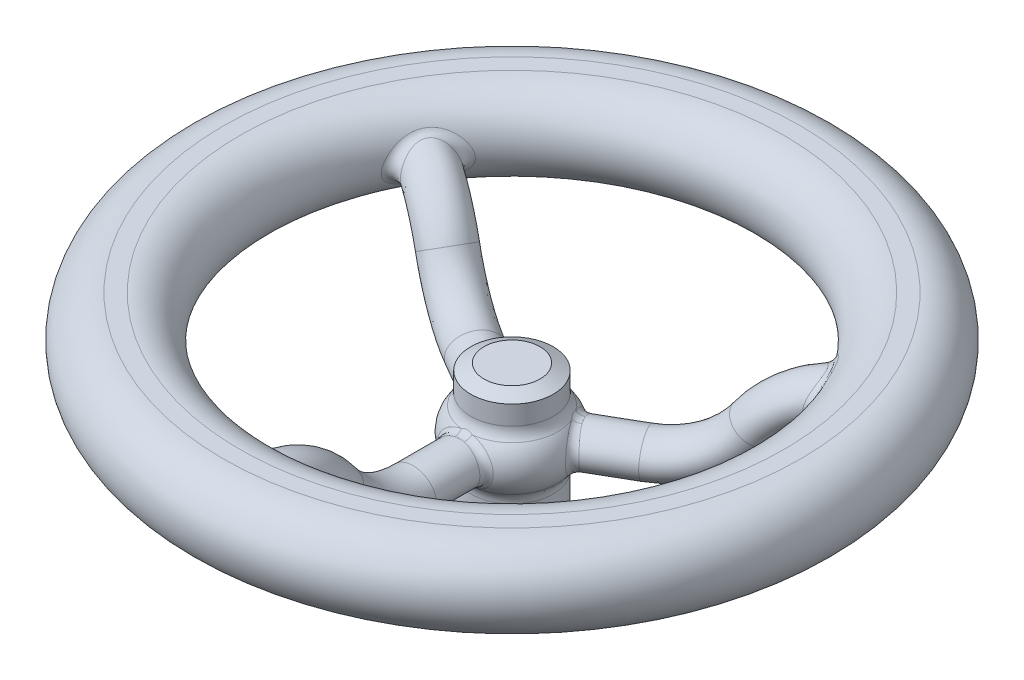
SolidWorks part; units mm, degrees
ref_plane "Front Plane" through (0, 0, 0) normal (0, 0, 1) x (1, 0, 0)
ref_plane "Top Plane" through (0, 0, 0) normal (0, 1, 0) x (1, 0, 0)
ref_plane "Right Plane" through (0, 0, 0) normal (1, 0, 0) x (0, 0, -1)
sketch "Sketch1" plane through (0, 0, 0) normal (1, 0, 0) x (0, 0, -1)
  line L0 (-12.5, 37.198) -> (-12.5, 45)
  line L1 (0, 0) -> (-12.5, 0)
  line L2 (0, 0) -> (0, 45) construction
  line L3 (0, 45) -> (-12.5, 45)
  line L4 (-12.5, 0) -> (-12.5, 16.802)
  line L5 (0, 0) -> (0, 45)
  arc A0 (-13.8333, 33.7987) -> (-13.8333, 20.2013) centre (-6.5, 27) ccw
  arc A1 (-13.8333, 20.2013) -> (-12.5, 16.802) centre (-17.5, 16.802) cw
  arc A2 (-13.8333, 33.7987) -> (-12.5, 37.198) centre (-17.5, 37.198) ccw
  point P10 (-12.5, 19)
  point P13 (-12.5, 35)
  dimension "D6" = 5
  dimension "D1" = 4
  dimension "D2" = 16
  dimension "D3" = 10
  dimension "D4" = 45
  dimension "D5" = 25
revolve "Hub" add sketch "Sketch1" angle 360 about L2
sketch "Sketch2" plane through (0, 0, 0) normal (1, 0, 0) x (0, 0, -1)
  line L0 (-87.5, 51) -> (-82.5, 51) construction
  line L1 (-87.5, 63.5) -> (-82.5, 63.5)
  line L2 (-87.5, 38.5) -> (-82.5, 38.5)
  line L3 (0, 0) -> (0, 50000) construction
  line L4 (12.5, 45) -> (-12.5, 45) construction
  arc A0 (-87.5, 63.5) -> (-87.5, 38.5) centre (-87.5, 51) ccw
  arc A1 (-82.5, 38.5) -> (-82.5, 63.5) centre (-82.5, 51) ccw
  point P2 (-85, 51)
  dimension "D1" = 25
  dimension "D2" = 30
  dimension "D3" = 170
  dimension "D4" = 6
revolve "Rim" add sketch "Sketch2" angle 360 about L3
sketch "Sketch4" plane through (0, 0, 0) normal (1, 0, 0) x (0, 0, -1)
  line L0 (0, 27) -> (-30, 27)
  line L1 (0, 0) -> (0, 45) construction
  line L2 (-76.9894, 51) -> (-85, 51)
  arc A0 (-30, 27) -> (-53.4947, 39) centre (-30, 56) cw
  arc A1 (-53.4947, 39) -> (-76.9894, 51) centre (-76.9894, 22) ccw
  dimension "D1" = 29
  dimension "D2" = 55
sketch "Sketch5" plane through (0, 0, 0) normal (0, 0, 1) x (1, 0, 0)
  ellipse E0 centre (0, 27) end of major axis (7, 27) minor radius 6
  point P1 (0, 0)
  point P7 (0, 0)
  point P9 (0, 0)
  dimension "D1" = 14
  dimension "D2" = 12
sweep "Spoke" add profiles "Sketch5" path "Sketch4"
pattern_circular "CirPattern1" count 3 over 360 of "Spoke"
fillet "Fillet1" radius 3 6 edges at (16.344, 25.7108, -1.5421) (-6.8365, 25.7108, 14.9253) (-9.5075, 25.7108, -13.3833) (-6.9999, 50.1029, 69.6815) (-57.0989, 48.7407, -40.8483) (63.9251, 48.7407, -29.0249)
chamfer "Chamfer1" distance 4 distance2 2 1 edges at (0, 45, -12.5)
